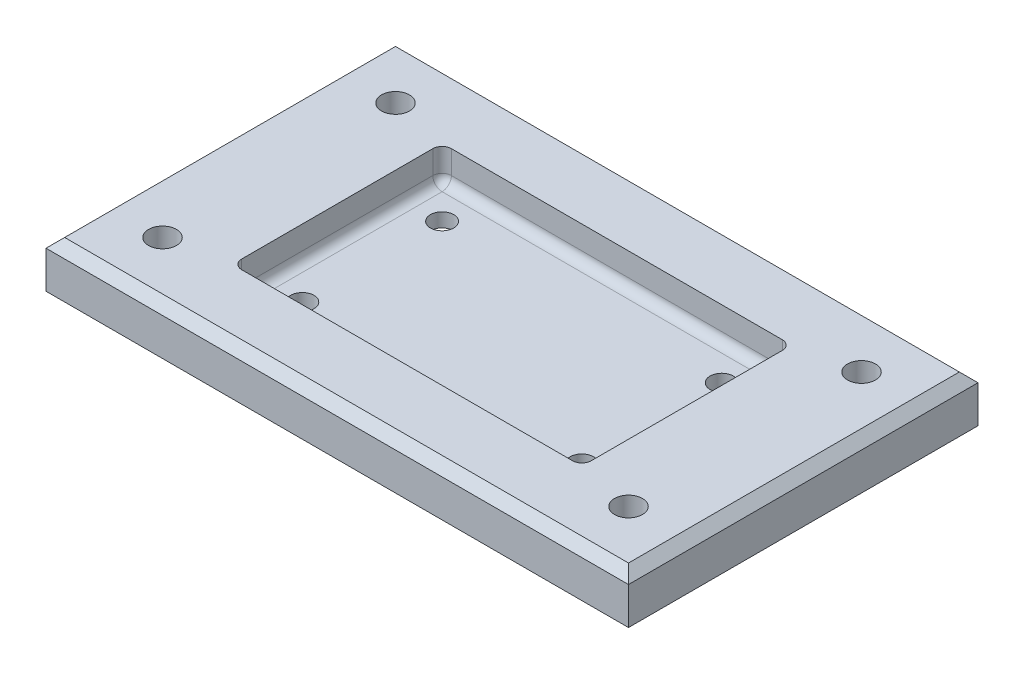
SolidWorks part; units mm, degrees
ref_plane "Front Plane" through (0, 0, 0) normal (0, 0, 1) x (1, 0, 0)
ref_plane "Top Plane" through (0, 0, 0) normal (0, 1, 0) x (1, 0, 0)
ref_plane "Right Plane" through (0, 0, 0) normal (1, 0, 0) x (0, 0, -1)
sketch "Sketch1" plane through (0, 0, 0) normal (0, 1, 0) x (1, 0, 0)
  line L1 (-62.5, -37.5) -> (62.5, -37.5)
  line L2 (-62.5, -37.5) -> (-62.5, 37.5)
  line L3 (-62.5, 37.5) -> (62.5, 37.5)
  line L4 (62.5, -37.5) -> (62.5, 37.5)
  line L5 (-62.5, -37.5) -> (62.5, 37.5) construction
  line L6 (-62.5, 37.5) -> (62.5, -37.5) construction
  point P0 (0, 0)
  dimension "D1" = 125
  dimension "D2" = 75
extrude "Base Feature" add sketch "Sketch1" along normal blind 10
sketch "Sketch2" plane through (0, 10, 0) normal (0, 1, 0) x (1, 0, 0)
  line L0 (62.5, 37.5) -> (-62.5, 37.5) construction
  line L1 (-37.5, -22.5) -> (37.5, -22.5)
  line L2 (-37.5, -22.5) -> (-37.5, 22.5)
  line L3 (-37.5, 22.5) -> (37.5, 22.5)
  line L4 (37.5, -22.5) -> (37.5, 22.5)
  line L5 (-37.5, -22.5) -> (37.5, 22.5) construction
  line L6 (-37.5, 22.5) -> (37.5, -22.5) construction
  line L7 (-62.5, 37.5) -> (-62.5, -37.5) construction
  point P0 (0, 0)
  dimension "D1" = 15
  dimension "D2" = 25
extrude "Pocket" cut sketch "Sketch2" against normal offset from surface (7 mm away) 3
hole_wizard "Ø6.0 (6) Diameter Hole1" positions "3DSketch2" profile "Sketch4" hole size "Ø6.0" standard "Ansi Metric"
sketch3d "3DSketch2"
  line L3 (62.5, 10, 37.5) -> (62.5, 10, -37.5) construction
  line L4 (-62.5, 10, 37.5) -> (62.5, 10, 37.5) construction
  point P0 (50, 10, 25)
  dimension "D1" = 12.5
  dimension "D2" = 12.5
sketch "Sketch4" plane through (50, 10, 25) normal (1, 0, 0) x (0, 0, 1)
  line L0 (0, 0) -> (0, 8.7321)
  line L1 (0, 8.7321) -> (3, 7)
  line L2 (3, 7) -> (3, 0)
  line L5 (3, 0) -> (0, 0)
  line L10 (0, 8.7321) -> (-3, 7) construction
  line L11 (0, -6.35) -> (0, 107.95) construction
  dimension "Hole Dia." = 6
  dimension "Hole Depth" = 7
  dimension "Drill Angle" = 120
pattern_linear "D6x4 Holes" count 2 spacing 100 along (-1, 0, 0) count 2 spacing 50 along (0, 0, -1) of "Ø6.0 (6) Diameter Hole1"
other "Dia 5 Hole"
sketch "Sketch5" plane through (0, 3, 0) normal (0, 1, 0) x (-1, 0, 0)
  line L0 (37.5, -22.5) -> (37.5, 22.5) construction
  line L1 (37.5, 22.5) -> (-37.5, 22.5) construction
  circle A0 centre (30, 15) radius 2.5
  dimension "D1" = 5
  dimension "D2" = 7.5
  dimension "D3" = 7.5
pattern_linear "Dia 5x4" count 2 spacing 30 along (0, 0, -1) count 2 spacing 60 along (1, 0, 0) of "Dia 5 Hole"
fillet "Fillet1" radius 2 8 edges at (0, 3, -22.5) (-37.5, 3, 0) (-37.5, 6.5, 22.5) (0, 3, 22.5) (37.5, 6.5, 22.5) (37.5, 3, 0) (37.5, 6.5, -22.5) (-37.5, 6.5, -22.5)
chamfer "Chamfer2" distance 2 angle 45 4 edges at (62.5, 10, 0) (0, 10, -37.5) (-62.5, 10, 0) (0, 10, 37.5)
